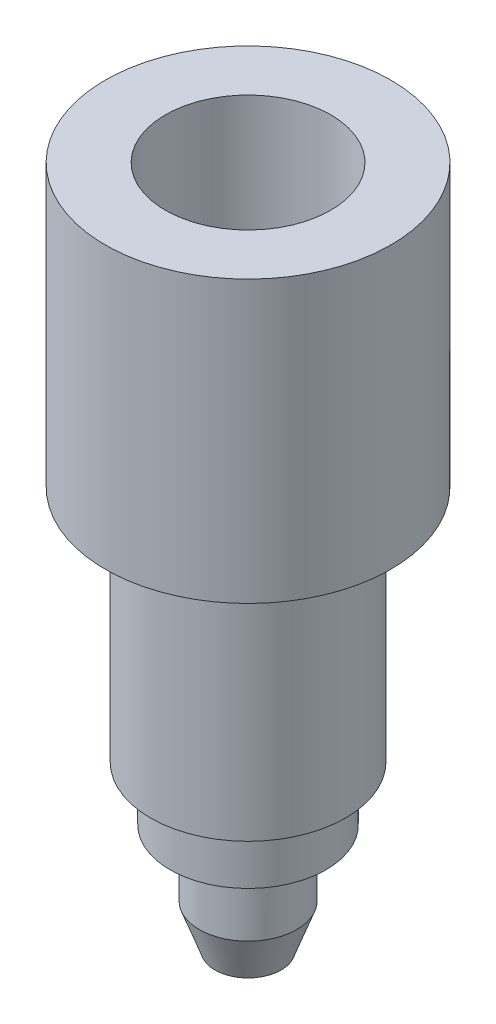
SolidWorks part; units mm, degrees
ref_plane "Front Plane" through (0, 0, 0) normal (0, 0, 1) x (1, 0, 0)
ref_plane "Top Plane" through (0, 0, 0) normal (0, 1, 0) x (1, 0, 0)
ref_plane "Right Plane" through (0, 0, 0) normal (1, 0, 0) x (0, 0, -1)
sketch "Sketch1" plane through (0, 0, 0) normal (0, 0, 1) x (1, 0, 0)
  line L0 (0, 0) -> (0, 71.6346) construction
  line L1 (-1.27, 12.6746) -> (-2.6924, 15.2146)
  line L2 (-1.5875, 1.3957) -> (-1.5875, 3.556)
  line L3 (-1.5875, 3.556) -> (-2.54, 3.556)
  line L4 (-3.175, 5.334) -> (-3.175, 12.319)
  line L5 (-3.937, 13.081) -> (-4.6482, 13.081)
  line L6 (-4.6482, 13.081) -> (-4.6482, 22.225)
  line L7 (-4.6482, 22.225) -> (-2.6924, 22.225)
  line L8 (-1.27, 12.6746) -> (0, 12.6746)
  line L9 (-2.6924, 22.225) -> (-2.6924, 15.2146)
  line L10 (0, 12.6746) -> (0, 0)
  line L11 (0, 0) -> (-1.0795, 0)
  line L12 (-1.0795, 0) -> (-1.5875, 1.3957)
  line L13 (-3.175, 12.319) -> (-3.937, 13.081)
  line L14 (-2.54, 3.556) -> (-2.54, 5.334)
  line L15 (-2.54, 5.334) -> (-3.175, 5.334)
  dimension "D1" = 6.35
  dimension "D2" = 20
  dimension "D3" = 9.2964
  dimension "D4" = 9.144
  dimension "D5" = 9.5504
  dimension "D6" = 3.556
  dimension "D7" = 5.3848
  dimension "D8" = 22.225
  dimension "D9" = 3.175
  dimension "D10" = 2.159
  dimension "D11" = 2.54
  dimension "D12" = 45
  dimension "D13" = 0.762
  dimension "D14" = 2.54
  dimension "D15" = 1.778
  dimension "D16" = 5.08
revolve "Revolve1" add sketch "Sketch1" angle 360 about L0
sketch "Sketch2" plane through (0, 22.225, 0) normal (0, 1, 0) x (1, 0, 0)
  line L1 (4.5827, 0) -> (2.2914, 3.9688)
  line L2 (2.2914, 3.9688) -> (-2.2914, 3.9688)
  line L3 (-2.2914, 3.9688) -> (-4.5827, 0)
  line L4 (-4.5827, 0) -> (-2.2914, -3.9687)
  line L5 (-2.2914, -3.9687) -> (2.2914, -3.9687)
  line L6 (2.2914, -3.9687) -> (4.5827, 0)
  circle A0 centre (0, 0) radius 3.9687 construction
  dimension "D1" = 7.9375
extrude "Cut-Extrude1" [suppressed] cut sketch "Sketch2" against normal through all flip side to cut
fillet "Fillet1" radius 0.508 1 edges at (0, 3.556, -1.5875)
